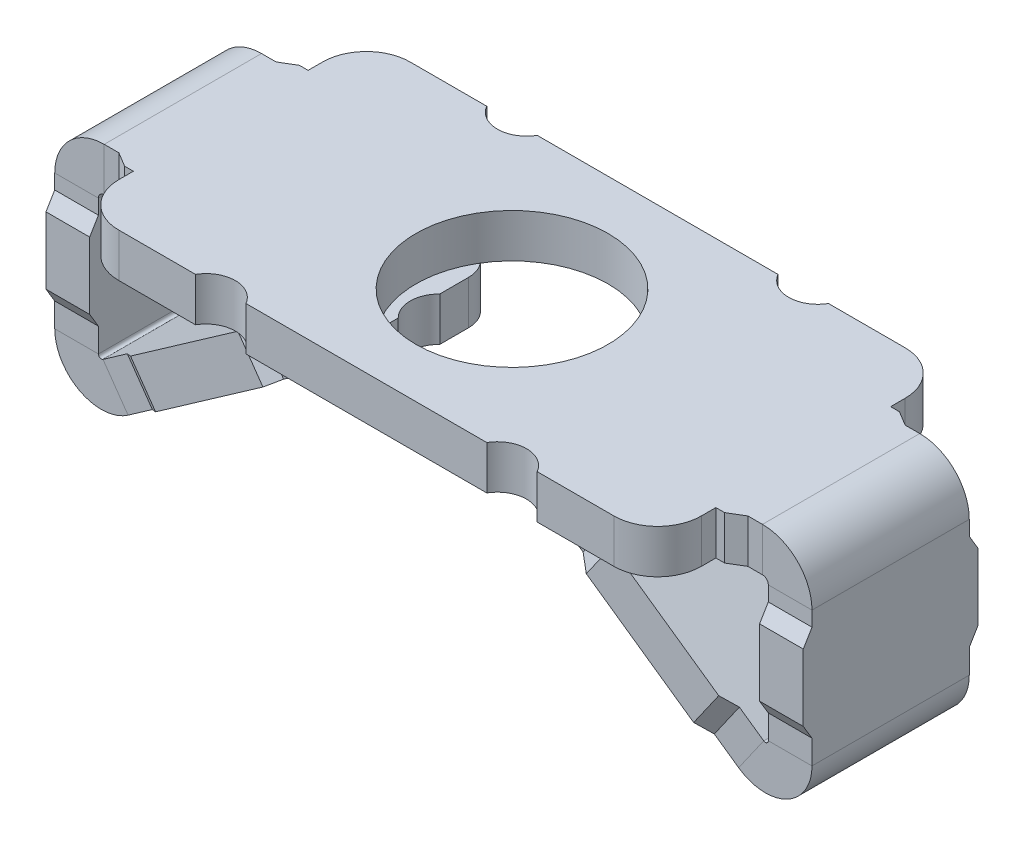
SolidWorks part; units mm, degrees
ref_plane "正面" through (0, 0, 0) normal (0, 0, 1) x (1, 0, 0)
ref_plane "平面" through (0, 0, 0) normal (0, 1, 0) x (1, 0, 0)
ref_plane "右側面" through (0, 0, 0) normal (1, 0, 0) x (0, 0, -1)
sketch "ｽｹｯﾁ2" plane through (0, 0, 0) normal (0, 1, 0) x (1, 0, 0)
  line L0 (5.866, 0) -> (14.134, 0)
  line L1 (1.5, 0) -> (4.134, 0)
  line L2 (0, 1.5) -> (0, 2)
  line L3 (1.5, 10) -> (4.134, 10)
  line L4 (20, 1.5) -> (20, 2)
  line L5 (15.866, 0) -> (18.5, 0)
  line L6 (15.866, 10) -> (18.5, 10)
  line L7 (5.866, 10) -> (14.134, 10)
  line L8 (0, 8) -> (0, 8.5)
  line L9 (-15.3, 2) -> (-10.8, 2)
  line L10 (-18.3, 3.3) -> (-18.3, 4.2859)
  line L11 (-15.3, 8) -> (-10.8, 8)
  line L13 (20, 8) -> (20, 8.5)
  line L14 (23.8, 8) -> (23.3, 7.7)
  line L15 (20.8, 7.7) -> (20.3, 8)
  line L16 (-18.3, 5.7141) -> (-18.3, 6.7)
  line L17 (23.3, 7.7) -> (20.8, 7.7)
  line L18 (-17.3, 2.3) -> (-15.8, 2.3)
  line L19 (-6.6, 7.7) -> (-6.1, 8)
  line L20 (20.8, 2.3) -> (20.3, 2)
  line L21 (23.8, 2) -> (23.3, 2.3)
  line L22 (-17.3, 7.7) -> (-15.8, 7.7)
  line L23 (23.3, 2.3) -> (20.8, 2.3)
  line L24 (-10.3, 7.7) -> (-6.6, 7.7)
  line L25 (-15.8, 2.3) -> (-15.3, 2)
  line L26 (-15.8, 7.7) -> (-15.3, 8)
  line L27 (-6.6, 2.3) -> (-6.1, 2)
  line L28 (-10.8, 2) -> (-10.3, 2.3)
  line L29 (-10.8, 8) -> (-10.3, 7.7)
  line L30 (20.3, 8) -> (20, 8)
  line L31 (20.3, 2) -> (20, 2)
  line L32 (30.3, 2.3) -> (26.6, 2.3)
  line L33 (-6.1, 8) -> (-3.8, 8)
  line L34 (-6.1, 2) -> (-3.8, 2)
  line L35 (26.1, 2) -> (23.8, 2)
  line L36 (-10.3, 2.3) -> (-6.6, 2.3)
  line L37 (26.1, 8) -> (23.8, 8)
  line L38 (30.8, 8) -> (30.3, 7.7)
  line L39 (30.8, 2) -> (30.3, 2.3)
  line L40 (26.6, 2.3) -> (26.1, 2)
  line L41 (35.8, 7.7) -> (35.3, 8)
  line L42 (35.8, 2.3) -> (35.3, 2)
  line L43 (-0.3, 2) -> (0, 2)
  line L44 (-0.3, 8) -> (0, 8)
  line L45 (30.3, 7.7) -> (26.6, 7.7)
  line L46 (-3.3, 2.3) -> (-0.8, 2.3)
  line L47 (37.3, 7.7) -> (35.8, 7.7)
  line L48 (-3.8, 2) -> (-3.3, 2.3)
  line L49 (-0.8, 2.3) -> (-0.3, 2)
  line L50 (26.6, 7.7) -> (26.1, 8)
  line L51 (37.3, 2.3) -> (35.8, 2.3)
  line L52 (-3.3, 7.7) -> (-0.8, 7.7)
  line L53 (-0.8, 7.7) -> (-0.3, 8)
  line L54 (-3.8, 8) -> (-3.3, 7.7)
  line L55 (38.3, 5.7141) -> (38.3, 6.7)
  line L56 (35.3, 8) -> (30.8, 8)
  line L57 (38.3, 3.3) -> (38.3, 4.2859)
  line L58 (35.3, 2) -> (30.8, 2)
  arc A0 (4.134, 10) -> (5.866, 10) centre (5, 10.5) ccw
  arc A1 (14.134, 10) -> (15.866, 10) centre (15, 10.5) ccw
  arc A2 (5.866, 0) -> (4.134, 0) centre (5, -0.5) ccw
  arc A3 (15.866, 0) -> (14.134, 0) centre (15, -0.5) ccw
  arc A4 (1.5, 10) -> (0, 8.5) centre (1.5, 8.5) ccw
  arc A5 (1.5, 0) -> (0, 1.5) centre (1.5, 1.5) cw
  arc A6 (20, 1.5) -> (18.5, 0) centre (18.5, 1.5) cw
  arc A7 (18.5, 10) -> (20, 8.5) centre (18.5, 8.5) cw
  arc A8 (38.3, 4.2859) -> (38.3, 5.7141) centre (39, 5) cw
  arc A9 (38.3, 6.7) -> (37.3, 7.7) centre (37.3, 6.7) ccw
  arc A10 (-18.3, 3.3) -> (-17.3, 2.3) centre (-17.3, 3.3) ccw
  arc A11 (-18.3, 6.7) -> (-17.3, 7.7) centre (-17.3, 6.7) cw
  arc A12 (38.3, 3.3) -> (37.3, 2.3) centre (37.3, 3.3) cw
  arc A13 (-18.3, 4.2859) -> (-18.3, 5.7141) centre (-19, 5) ccw
  circle A14 centre (10, 5) radius 3.3
  point P21 (0, 0)
  point P24 (20, 0)
  point P27 (20, 10)
  dimension "D3" = 2
  dimension "D4" = 5
  dimension "D5" = 5
  dimension "D6" = 0.5
  dimension "D7" = 1.5
  dimension "D12" = 0.5
  dimension "D13" = 0.5
  dimension "D14" = 2.3
  dimension "D16" = 0.7
  dimension "D17" = 6.6
  dimension "D18" = 5
  dimension "D19" = 10
  dimension "D20" = 1
  dimension "D1" = 20
  dimension "D2" = 10
  dimension "D9" = 18.3
  dimension "D10" = 2.5
  dimension "D11" = 6
  dimension "D21" = 5.4
  dimension "D22" = 3.7
  dimension "D23" = 1.5
  dimension "D24" = 0.5
  dimension "D25" = 4.5
  dimension "D26" = 0.5
  dimension "D27" = 0.5
sheet metal parameters "板金1" thickness 1.5 parameters "D1"=0.7366
base flange "ﾍﾞｰｽ-ﾌﾗﾝｼﾞ1" sketch "ｽｹｯﾁ2" thickness 1.5 reverse thickness direction yes parameters "D1"=0.7366
sketch "ｽｹｯﾁ12" plane through (0, 0, 0) normal (0, -1, 0) x (1, 0, 0)
  line L0 (-16.8, -3.7137) -> (-16.8, -6.047)
  line L1 (36.8, -3.7137) -> (36.8, -6.4059)
  line L2 (-18.3, -6.7) -> (-18.3, -5.7141) construction
  dimension "D1" = 53.6
  dimension "D2" = 1.5
sketched bend "ｽｹｯﾁ ﾍﾞﾝﾄﾞ7" parameters "D1"=0.1
bend "ｽｹｯﾁﾍﾞﾝﾄﾞ14" bend radius 0.1 bend angle 35 parameters "D5"=5
bend "ｽｹｯﾁﾍﾞﾝﾄﾞ15" bend radius 0.1 bend angle 35 parameters "D5"=6
sketch "ｽｹｯﾁ11" plane through (0, 0, 0) normal (0, -1, 0) x (1, 0, 0)
  line L0 (-10.5, -3.7137) -> (-10.5, -6.3461)
  line L1 (30.5, -3.7137) -> (30.5, -6.3461)
  circle A0 centre (10, -5) radius 3.3 construction
  dimension "D1" = 41
  dimension "D2" = 20.5
sketched bend "ｽｹｯﾁ ﾍﾞﾝﾄﾞ6" parameters "D1"=0.1
bend "ｽｹｯﾁﾍﾞﾝﾄﾞ12" bend radius 0.1 bend angle 125 parameters "D5"=3
bend "ｽｹｯﾁﾍﾞﾝﾄﾞ13" bend radius 0.1 bend angle 125 parameters "D5"=4
sketch "ｽｹｯﾁ8" plane through (0, 0, 0) normal (0, -1, 0) x (1, 0, 0)
  line L0 (-3, -3.3548) -> (-3, -6.3461)
  line L1 (23, -3.3548) -> (23, -6.3461)
  circle A0 centre (10, -5) radius 3.3 construction
  dimension "D1" = 26
  dimension "D2" = 13
sketched bend "ｽｹｯﾁ ﾍﾞﾝﾄﾞ5" parameters "D1"=0.2
bend "ｽｹｯﾁﾍﾞﾝﾄﾞ6" bend radius 0.2 bend angle 90 parameters "D5"=1
bend "ｽｹｯﾁﾍﾞﾝﾄﾞ7" bend radius 0.2 bend angle 90 parameters "D5"=2
flat pattern "ﾌﾗｯﾄ-ﾊﾟﾀｰﾝ1"
sketch "ﾍﾞﾝﾄﾞ-ﾗｲﾝ1" plane through (0, 1.5, 0) normal (0, 1, 0) x (-1, 0, 0)
  line L0 (-36.5551, -2.3) -> (-36.5551, -7.7) construction
  line L1 (16.5551, -2.3) -> (16.5551, -7.7) construction
  line L2 (-28.3536, -2.3) -> (-28.3536, -7.7) construction
  line L3 (8.3536, -2.3) -> (8.3536, -7.7) construction
  line L4 (-22.0461, -2.3) -> (-22.0461, -7.7) construction
  line L5 (2.0461, -2.3) -> (2.0461, -7.7) construction
  line L6 (-36.5551, -2.3) -> (-36.5551, -7.7) construction
  line L7 (16.5551, -2.3) -> (16.5551, -7.7) construction
  line L8 (-28.3536, -2.3) -> (-28.3536, -7.7) construction
  line L9 (8.3536, -2.3) -> (8.3536, -7.7) construction
  line L10 (-22.0461, -2.3) -> (-22.0461, -7.7) construction
  line L11 (2.0461, -2.3) -> (2.0461, -7.7) construction
bend of the flat pattern "ﾌﾗｯﾄ-<ｽｹｯﾁﾍﾞﾝﾄﾞ6>1"
bend of the flat pattern "ﾌﾗｯﾄ-<ｽｹｯﾁﾍﾞﾝﾄﾞ7>1"
bend of the flat pattern "ﾌﾗｯﾄ-<ｽｹｯﾁﾍﾞﾝﾄﾞ12>1"
bend of the flat pattern "ﾌﾗｯﾄ-<ｽｹｯﾁﾍﾞﾝﾄﾞ13>1"
bend of the flat pattern "ﾌﾗｯﾄ-<ｽｹｯﾁﾍﾞﾝﾄﾞ14>1"
bend of the flat pattern "ﾌﾗｯﾄ-<ｽｹｯﾁﾍﾞﾝﾄﾞ15>1"
